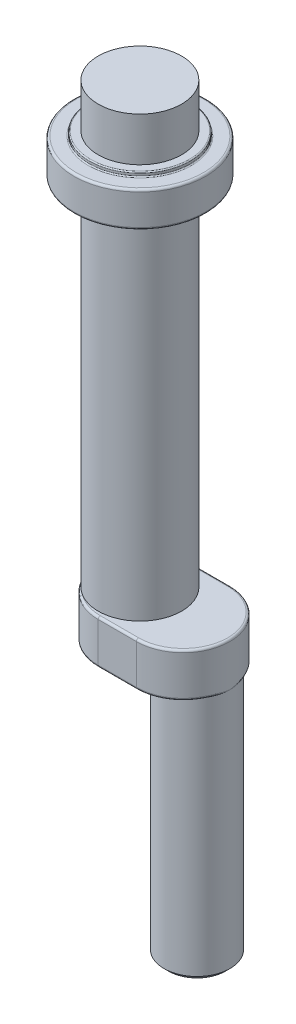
SolidWorks part; units mm, degrees
ref_plane "Front Plane" through (0, 0, 0) normal (0, 0, 1) x (1, 0, 0)
ref_plane "Top Plane" through (0, 0, 0) normal (0, 1, 0) x (1, 0, 0)
ref_plane "Right Plane" through (0, 0, 0) normal (1, 0, 0) x (0, 0, -1)
sketch "Sketch1" plane through (0, 0, 0) normal (0, 1, 0) x (1, 0, 0)
  line L0 (0, 0) -> (0, 22.4319) construction
  line L1 (-4.3568, 10.6432) -> (4.3568, 10.6432)
  line L3 (-4.3568, -10.6432) -> (4.3568, -10.6432)
  line L7 (-15, 0) -> (15, 0) construction
  arc A0 (-4.3568, -10.6432) -> (-4.3568, 10.6432) centre (-4.3568, 0) cw
  arc A1 (4.3568, -10.6432) -> (4.3568, 10.6432) centre (4.3568, 0) ccw
  point P0 (0, 0)
  dimension "D3" = 10.6432
  dimension "D1" = 15
  dimension "D4" = 8.7137
extrude "Boss-Extrude1" add sketch "Sketch1" along normal mid plane 10 contours L3 A1 L1 A0
sketch "Sketch2" plane through (0, 5, 0) normal (0, 1, 0) x (1, 0, 0)
  line L0 (-17, 0) -> (-2, 0) construction
  circle A1 centre (-5.5, 0) radius 9.5
  arc A2 (-4.3568, 10.6432) -> (-4.3568, -10.6432) centre (-4.3568, 0) ccw construction
  dimension "D1" = 19
extrude "Boss-Extrude2" add sketch "Sketch2" along normal blind 100
sketch "Sketch3" plane through (0, -5, 0) normal (0, -1, 0) x (1, 0, 0)
  line L0 (0, 0) -> (15, 0) construction
  arc A0 (4.3568, -10.6432) -> (4.3568, 10.6432) centre (4.3568, 0) ccw construction
  circle A1 centre (7.5, 0) radius 7.5
  dimension "D1" = 15
extrude "Boss-Extrude3" add sketch "Sketch3" along normal blind 56 contours A1
sketch "Sketch4" plane through (0, 105, 0) normal (0, 1, 0) x (1, 0, 0)
  line L0 (-5.5, 9.5) -> (-5.5, -9.5) construction
  circle A0 centre (-5.5, 0) radius 9.5 construction
  circle A1 centre (-5.5, 0) radius 9.5 construction
ref_plane "Plane1" through (-5.5, 0, 0) normal (-1, 0, 0) x (0, 0, 1)
sketch "Sketch5" plane through (-5.5, 0, 0) normal (-1, 0, 0) x (0, 0, 1)
  line L0 (0, 105) -> (0, 61.7759) construction
  line L1 (-9.5, 105) -> (9.5, 105) construction
  line L2 (-9.5, 95) -> (-9.5, 85)
  line L3 (-11.75, 86) -> (-14.5, 86)
  line L5 (-11.5, 94.75) -> (-11.5, 94.25)
  line L6 (-11.75, 94) -> (-14.5, 94)
  line L7 (-11.5, 85.25) -> (-11.5, 85.75)
  line L8 (-9.5, 85) -> (-11.25, 85)
  line L11 (-9.5, 95) -> (-11.25, 95)
  line L12 (-15, 93.5) -> (-15, 86.5)
  line L13 (-15, 90) -> (81.7828, 90) construction
  arc A0 (-14.5, 94) -> (-15, 93.5) centre (-14.5, 93.5) ccw
  arc A1 (-11.5, 94.25) -> (-11.75, 94) centre (-11.75, 94.25) cw
  arc A2 (-11.5, 94.75) -> (-11.25, 95) centre (-11.25, 94.75) cw
  arc A3 (-14.5, 86) -> (-15, 86.5) centre (-14.5, 86.5) cw
  arc A4 (-11.5, 85.75) -> (-11.75, 86) centre (-11.75, 85.75) ccw
  arc A5 (-11.5, 85.25) -> (-11.25, 85) centre (-11.25, 85.25) ccw
  point P20 (-11.5, 95)
  dimension "D3" = 0.5
  dimension "D4" = 0.25
  dimension "D1" = 2
  dimension "D2" = 15
  dimension "D5" = 5
revolve "Revolve1" add sketch "Sketch5" angle 360 about L0
fillet "Fillet1" radius 0.5 10 edges at (-15, -5, 0) (0, -5, -10.6432) (11.8827, -5, -7.5259) (11.8827, -5, 7.5259) (0, 5, 10.6432) (-11.8827, 5, 7.5259) (-11.8827, 5, -7.5259) (0, 5, -10.6432) (0, -5, 10.6432) (15, 5, 0)
chamfer "Chamfer1" distance 1 angle 45 1 edges at (7.5, -61, -7.5)
sketch "Sketch6" plane through (0, 105, 0) normal (0, 1, 0) x (1, 0, 0)
  line L0 (-59.1203, 0) -> (48.1203, 0) construction
  point P5 (-5.5, 0)
